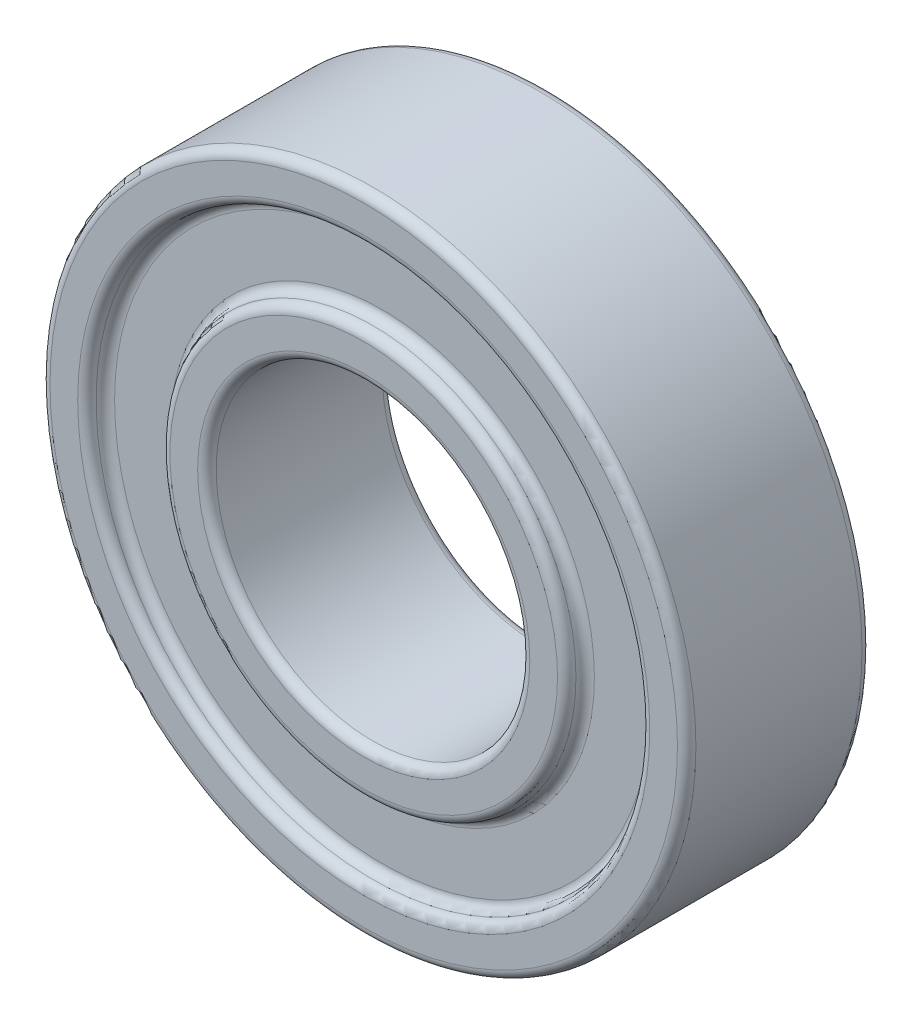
SolidWorks part; units mm, degrees
ref_plane "Plan1" through (0, 0, 0) normal (0, 0, 1) x (1, 0, 0)
ref_plane "Plan2" through (0, 0, 0) normal (0, 1, 0) x (1, 0, 0)
ref_plane "Plan3" through (0, 0, 0) normal (1, 0, 0) x (0, 0, -1)
sketch "Esquisse1" plane through (0, 0, 0) normal (0, 0, 1) x (1, 0, 0)
  circle A0 centre (0, 0) radius 8.5
  circle A1 centre (0, 0) radius 17.5
  dimension "D1" = 17
  dimension "D2" = 35
extrude "Base-Extrusion" add sketch "Esquisse1" along normal blind 10
sketch "Esquisse2" plane through (0, 0, 10) normal (0, 0, 1) x (1, 0, 0)
  circle A0 centre (0, 0) radius 15
  circle A1 centre (0, 0) radius 11
  dimension "D1" = 30
  dimension "D2" = 22
extrude "Enlèv. mat.-Extru.1" cut sketch "Esquisse2" against normal blind 1
sketch "Esquisse3" plane through (0, 0, 0) normal (0, 0, -1) x (-1, 0, 0)
  circle A0 centre (0, 0) radius 11
  circle A1 centre (0, 0) radius 15
  dimension "D1" = 22
  dimension "D2" = 30
extrude "Enlèv. mat.-Extru.2" cut sketch "Esquisse3" against normal blind 1
fillet "Congé3" radius 0.5
